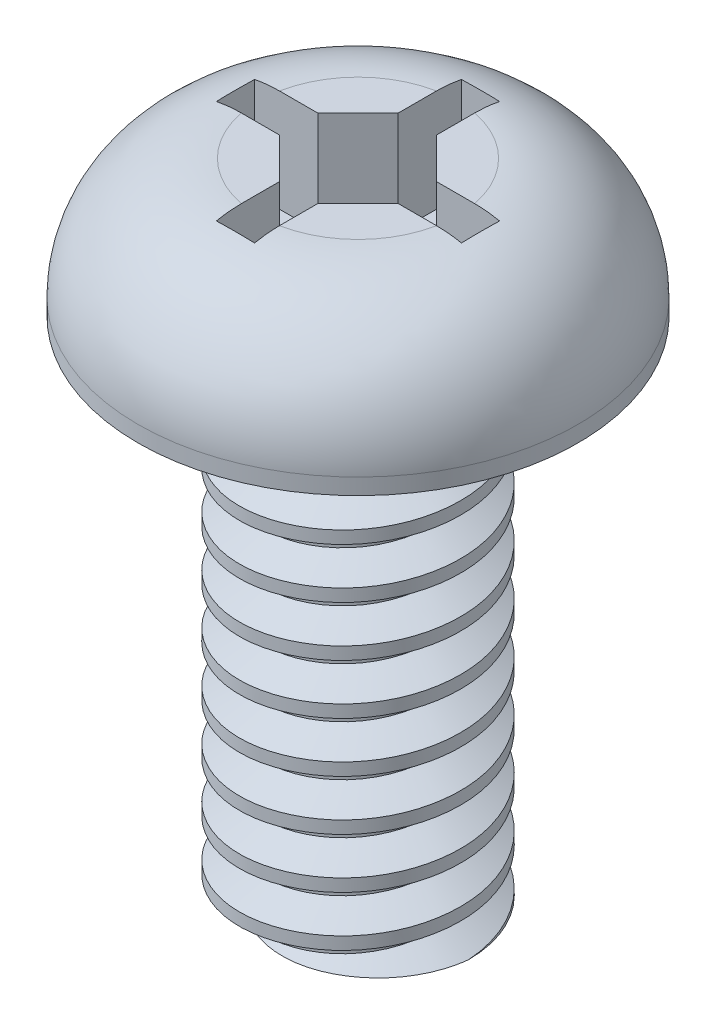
SolidWorks part; units mm, degrees
ref_plane "Front Plane" through (0, 0, 0) normal (0, 0, 1) x (1, 0, 0)
ref_plane "Top Plane" through (0, 0, 0) normal (0, 1, 0) x (1, 0, 0)
ref_plane "Right Plane" through (0, 0, 0) normal (1, 0, 0) x (0, 0, -1)
sketch "Sketch1" plane through (0, 0, 0) normal (0, 1, 0) x (1, 0, 0)
  circle A0 centre (0, 0) radius 2.7813
extrude "Boss-Extrude1" add sketch "Sketch1" along normal blind 1.7272
sketch "Sketch2" plane through (0, 1.7272, 0) normal (0, 1, 0) x (1, 0, 0)
  line L0 (0.7493, 0.2413) -> (1.5494, 0.2413)
  line L1 (-0.2413, -1.5494) -> (0.2413, -1.5494)
  line L2 (-0.2413, -1.5494) -> (-0.2413, -0.7493)
  line L3 (-0.2413, 1.5494) -> (0.2413, 1.5494)
  line L4 (0.2413, -1.5494) -> (0.2413, -0.7493)
  line L5 (-0.2413, 0.7493) -> (-0.2413, 1.5494)
  line L6 (0.2413, 0.7493) -> (0.2413, 1.5494)
  line L7 (-1.5494, 0.2413) -> (-0.7493, 0.2413)
  line L8 (-1.5494, 0.2413) -> (-1.5494, -0.2413)
  line L9 (-1.5494, -0.2413) -> (-0.7493, -0.2413)
  line L10 (1.5494, 0.2413) -> (1.5494, -0.2413)
  line L11 (0.7493, -0.2413) -> (1.5494, -0.2413)
  line L12 (-0.7493, 0.2413) -> (-0.2413, 0.7493)
  line L13 (0.2413, 0.7493) -> (0.7493, 0.2413)
  line L14 (-0.2413, -0.7493) -> (-0.7493, -0.2413)
  line L15 (0.2413, -0.7493) -> (0.7493, -0.2413)
  point P5 (-0.2413, 0.2413)
  point P11 (-0.2413, -0.2413)
  point P12 (0.2413, 0.2413)
  point P14 (0.2413, -0.2413)
extrude "Cut-Extrude1" cut sketch "Sketch2" against normal blind 1.2954
sketch "Sketch3" plane through (0, 0, 0) normal (0, -1, 0) x (1, 0, 0)
  circle A0 centre (0, 0) radius 1.397
extrude "Boss-Extrude2" add sketch "Sketch3" along normal blind 6.35
thread "Thread2" pitch 0.635 start angle 0, offset 1.27, length 7.239, pitch 0.635, diameter 2.794
ref_plane "Plane2" through (1.397, -7.62, 0) normal (0, 0, -1) x (-1, 0, 0)
sketch "Thread Profile2" plane through (1.397, -7.62, 0) normal (0, 0, -1) x (-1, 0, 0)
  line L0 (0, 0) -> (0, 0.635) construction
  line L1 (0, 0) -> (0.3437, 0.1984)
  line L2 (0.3437, 0.1984) -> (0.3437, 0.2778)
  line L3 (0.3437, 0.2778) -> (0, 0.4762)
  line L4 (0.3437, 0.2381) -> (0, 0.2381) construction
  line L11 (0, 0) -> (0, 0.4762)
  point P2 (0, 0)
  dimension "Pitch" = 0.635
  dimension "Profile_Angle" = 60
  dimension "Profile_Land" = 0.0794
  dimension "Profile_Height" = 0.3437
fillet "Fillet1" radius 1.524 1 edges at (0, 1.7272, 2.7813)
